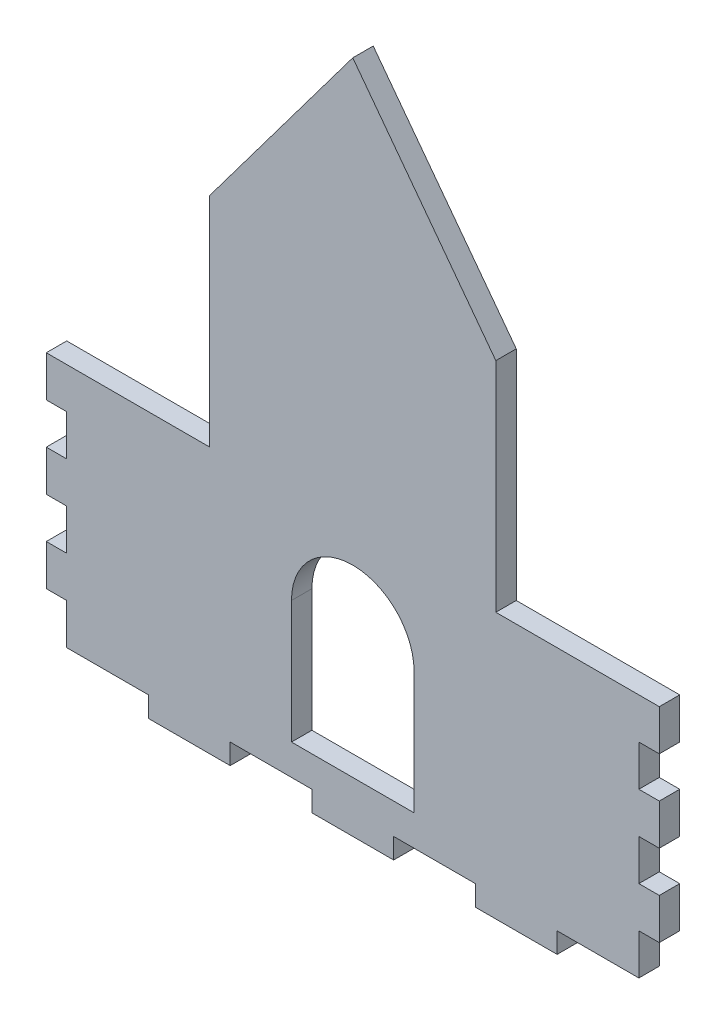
SolidWorks part; units mm, degrees
ref_plane "Front Plane" through (0, 0, 0) normal (0, 0, 1) x (1, 0, 0)
ref_plane "Top Plane" through (0, 0, 0) normal (0, 1, 0) x (1, 0, 0)
ref_plane "Right Plane" through (0, 0, 0) normal (1, 0, 0) x (0, 0, -1)
sketch "Sketch1" plane through (0, 0, 0) normal (0, 0, 1) x (1, 0, 0)
  line L0 (266.7, 152.4) -> (355.6, 152.4)
  line L1 (0, 0) -> (355.6, 0)
  line L2 (0, 0) -> (0, 152.4)
  line L3 (0, 152.4) -> (88.9, 152.4)
  line L4 (355.6, 0) -> (355.6, 152.4)
  line L5 (177.8, 152.4) -> (177.8, 406.4)
  line L6 (88.9, 152.4) -> (88.9, 287.8582)
  line L7 (88.9, 287.8582) -> (266.7, 287.8582)
  line L8 (266.7, 152.4) -> (266.7, 287.8582)
  line L9 (88.9, 287.8582) -> (177.8, 406.4)
  line L10 (177.8, 406.4) -> (266.7, 287.8582)
  dimension "D1" = 355.6
  dimension "D2" = 152.4
  dimension "D3" = 88.9
  dimension "D4" = 88.9
  dimension "D5" = 254
  dimension "D6" = 135.4582
extrude "Boss-Extrude1" add sketch "Sketch1" along normal blind 12.7
sketch "Sketch2" plane through (0, 0, 12.7) normal (0, 0, 1) x (1, 0, 0)
  line L0 (-12.7, 152.4) -> (368.3, 152.4)
  line L1 (368.3, 0) -> (-12.7, 0)
  line L2 (368.3, 25.4) -> (-12.7, 25.4)
  line L3 (-12.7, 127) -> (368.3, 127)
  line L13 (368.3, 50.8) -> (-12.7, 50.8)
  line L14 (-12.7, 101.6) -> (368.3, 101.6)
  line L15 (-12.7, 76.2) -> (368.3, 76.2)
  line L16 (0, 152.4) -> (0, 0)
  line L17 (355.6, 152.4) -> (355.6, 0)
  line L18 (-12.7, 152.4) -> (-12.7, 0)
  line L19 (368.3, 152.4) -> (368.3, 0)
  line L20 (0, 152.4) -> (355.6, 152.4) construction
  line L21 (0, 127) -> (355.6, 127) construction
  line L22 (0, 101.6) -> (355.6, 101.6) construction
  line L23 (0, 76.2) -> (355.6, 76.2) construction
  line L24 (355.6, 50.8) -> (0, 50.8) construction
  line L25 (355.6, 25.4) -> (0, 25.4) construction
  line L26 (355.6, 0) -> (0, 0) construction
  dimension "D1" = 25.4
  dimension "D2" = 25.4
  dimension "D3" = 25.4
  dimension "D4" = 12.7
  dimension "D5" = 12.7
extrude "Boss-Extrude2" add sketch "Sketch2" against normal blind 12.7 contours L0 L18 L3 M5 | L14 L18 L15 M5 | L13 L18 L2 M5 | L19 L0 L3 M7 | L19 L14 L15 M7 | L19 L13 L2 M7
sketch "Sketch3" plane through (0, 0, 0) normal (0, -1, 0) x (1, 0, 0)
  line L0 (0, 12.7) -> (0, 0)
  line L1 (355.6, 12.7) -> (355.6, 0)
  line L2 (304.8, 12.7) -> (304.8, 0)
  line L3 (254, 12.7) -> (254, 0)
  line L4 (50.8, 12.7) -> (50.8, 0)
  line L5 (152.4, 12.7) -> (152.4, 0)
  line L6 (101.6, 12.7) -> (101.6, 0)
  line L7 (203.2, 12.7) -> (203.2, 0)
  line L8 (0, 12.7) -> (355.6, 12.7)
  line L9 (355.6, 0) -> (0, 0)
  dimension "D1" = 50.8
  dimension "D2" = 50.8
  dimension "D3" = 50.8
  dimension "D4" = 101.6
  dimension "D5" = 50.8
  dimension "D6" = 50.8
extrude "Boss-Extrude3" add sketch "Sketch3" along normal blind 12.7 contours L6 L4 M3 M1 | L7 L5 M3 M1 | L3 L2 M3 M1
sketch "Sketch4" plane through (0, 0, 12.7) normal (0, 0, 1) x (1, 0, 0)
  line L0 (177.8, 0) -> (177.8, 19.05)
  line L2 (215.9, 19.05) -> (139.7, 19.05)
  line L3 (215.9, 19.05) -> (215.9, 95.25)
  line L4 (215.9, 95.25) -> (139.7, 95.25)
  line L5 (139.7, 19.05) -> (139.7, 95.25)
  arc A0 (139.7, 95.25) -> (215.9, 95.25) centre (177.8, 95.25) cw
  dimension "D1" = 19.05
  dimension "D2" = 76.2
  dimension "D3" = 76.2
extrude "Cut-Extrude1" cut sketch "Sketch4" against normal blind 12.7 contours L5 L2 L3 L4 | A0 L4
